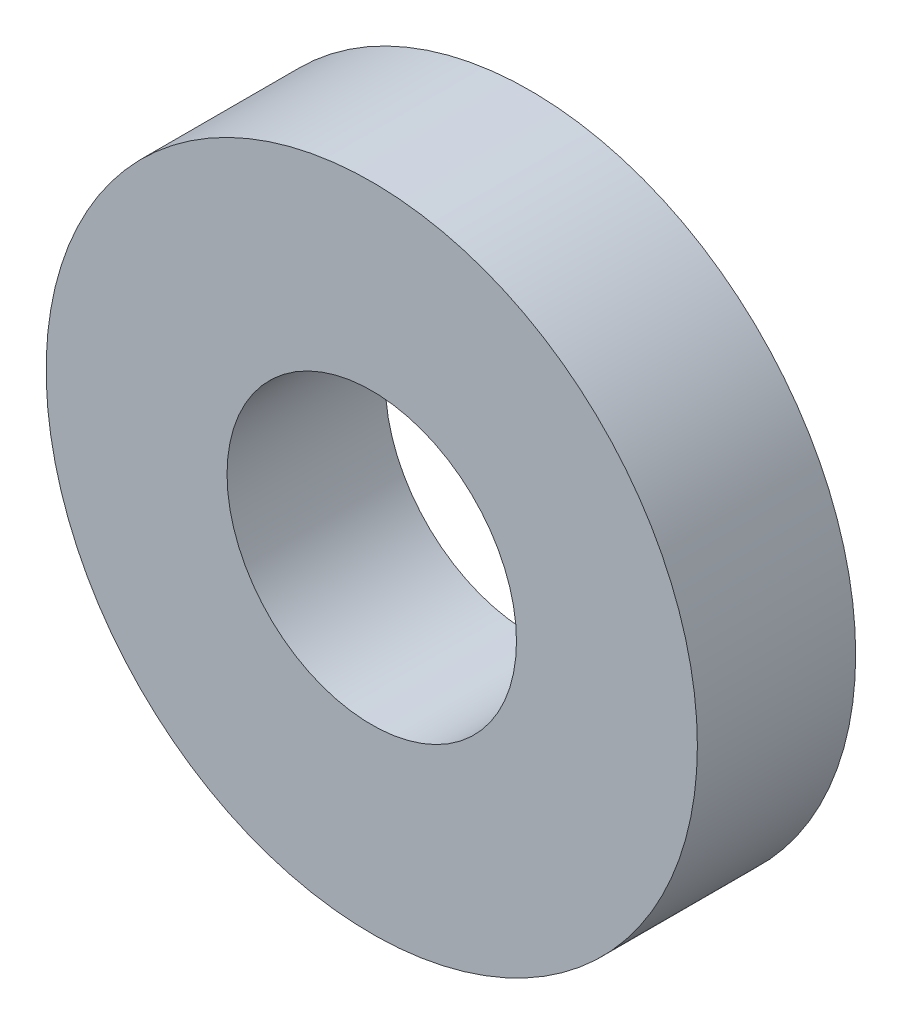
SolidWorks part; units mm, degrees
ref_plane "Front Plane" through (0, 0, 0) normal (0, 0, 1) x (1, 0, 0)
ref_plane "Top Plane" through (0, 0, 0) normal (0, 1, 0) x (1, 0, 0)
ref_plane "Right Plane" through (0, 0, 0) normal (1, 0, 0) x (0, 0, -1)
sketch "Sketch1" plane through (0, 0, 0) normal (0, 0, 1) x (1, 0, 0)
  circle A0 centre (0, 0) radius 3.2
  circle A1 centre (0, 0) radius 7.2
  dimension "D1" = 6.4
  dimension "D2" = 4
extrude "Boss-Extrude1" add sketch "Sketch1" along normal blind 3.5
